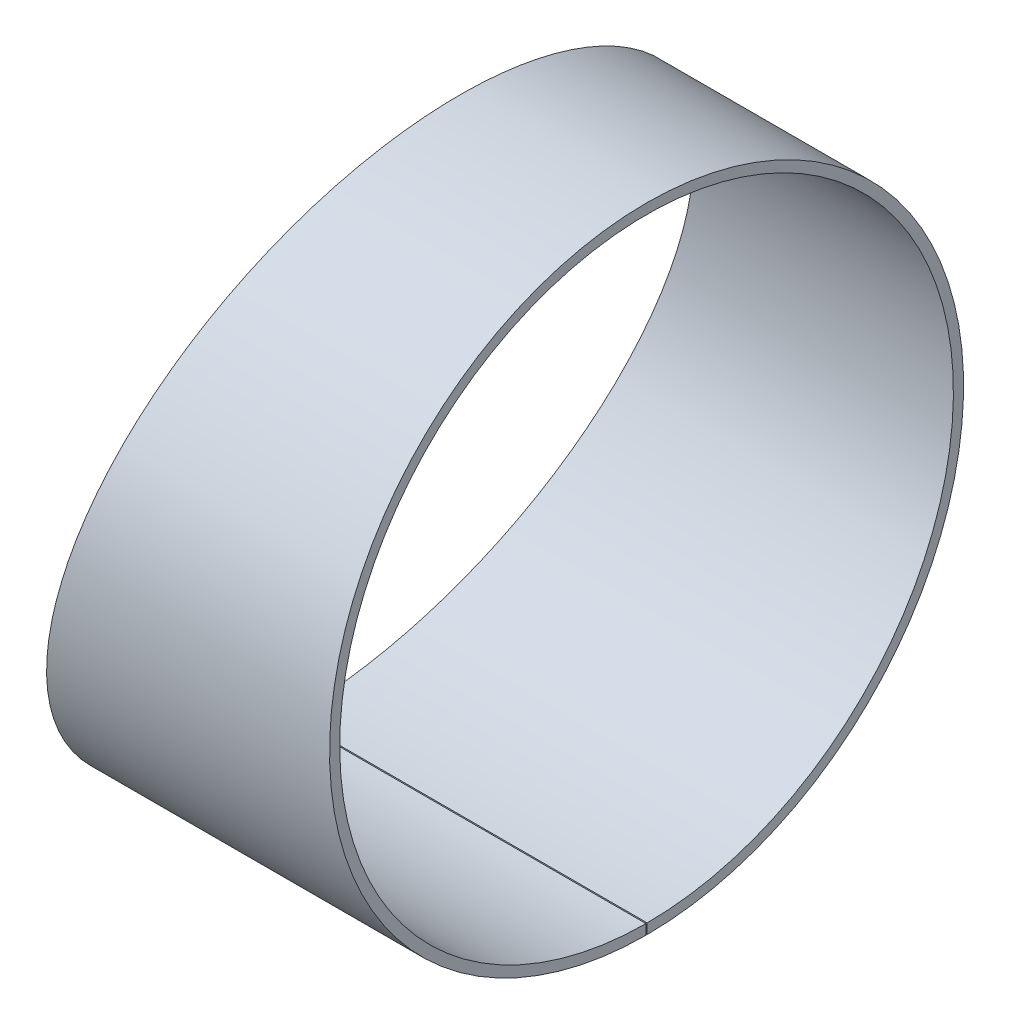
SolidWorks part; units mm, degrees
ref_plane "前视基准面" through (0, 0, 0) normal (0, 0, 1) x (1, 0, 0)
ref_plane "上视基准面" through (0, 0, 0) normal (0, 1, 0) x (1, 0, 0)
ref_plane "右视基准面" through (0, 0, 0) normal (1, 0, 0) x (0, 0, -1)
imported_body "基体零件-人字形三通管-1"
sheet metal parameters "钣金1" parameters "D1"=0.7366, "厚度"=8
bend "圆角折弯1" bend radius 242 bend angle 359.771 parameters "D5"=1
flatten bends "展开-折弯1"
sketch "尖角-草图1" plane through (659.3267, -1049.9995, 0.5) normal (0, -1, 0.002) x (1, 0, 0)
  line L0 (-140.6733, 759.7814) -> (140.6733, 759.7814) construction
  dimension "D1" = 0
process bends "加工-折弯1" parameters "D1"=0
sketch "平面-草图1" plane through (659.3267, -1049.9995, 0.5) normal (0, -1, 0.002) x (1, 0, 0)
